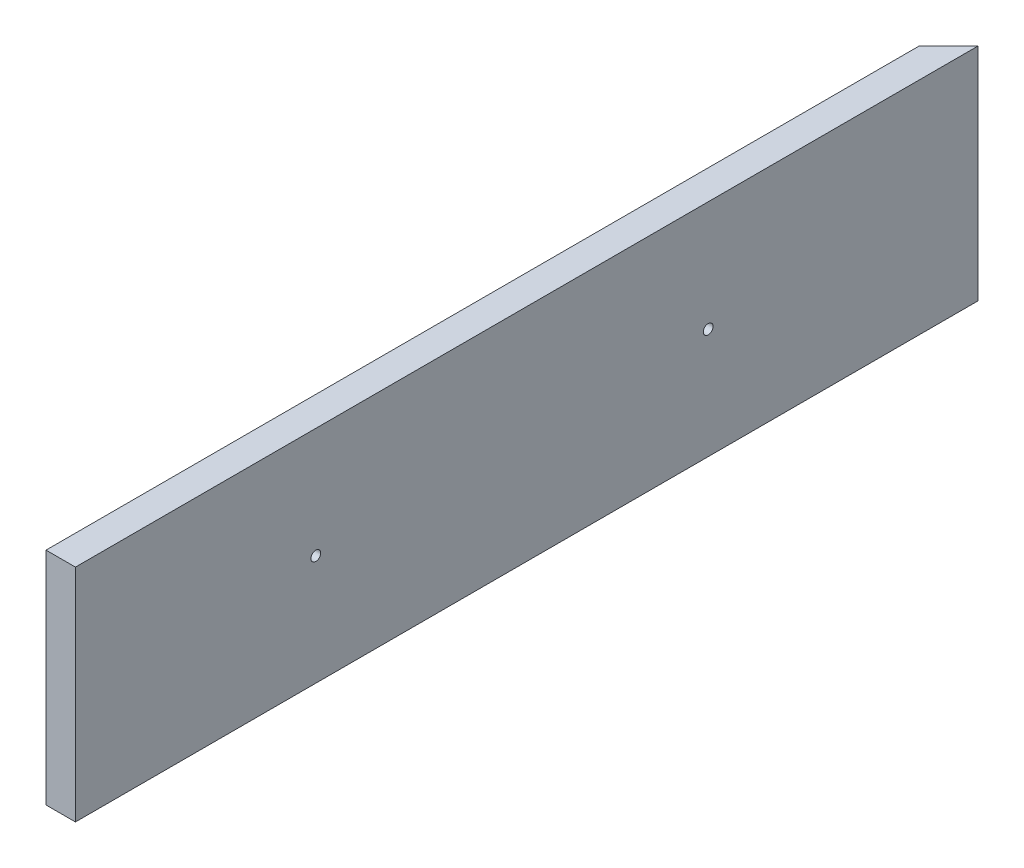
SolidWorks part; units mm, degrees
ref_plane "Front Plane" through (0, 0, 0) normal (0, 0, 1) x (1, 0, 0)
ref_plane "Top Plane" through (0, 0, 0) normal (0, 1, 0) x (1, 0, 0)
ref_plane "Right Plane" through (0, 0, 0) normal (1, 0, 0) x (0, 0, -1)
sketch "Sketch1" plane through (0, 0, 0) normal (0, 1, 0) x (1, 0, 0)
  line L0 (0, 1130.3) -> (38.1, 1168.4)
  line L1 (0, 0) -> (38.1, 0)
  line L2 (0, 0) -> (0, 1130.3)
  line L3 (0, 1130.3) -> (38.1, 1130.3) construction
  line L4 (38.1, 0) -> (38.1, 1130.3)
  line L5 (0, 0) -> (38.1, 1130.3) construction
  line L6 (0, 1130.3) -> (38.1, 0) construction
  line L7 (38.1, 1168.4) -> (38.1, 1130.3)
  point P4 (19.05, 565.15)
extrude "Boss-Extrude1" add sketch "Sketch1" along normal blind 285.75
sketch "Sketch2" plane through (0, 0, 0) normal (-1, 0, 0) x (0, 0, 1)
  line L0 (-1130.3, 142.875) -> (-819.15, 142.875) construction
  line L1 (-1130.3, 285.75) -> (-1130.3, 0) construction
  line L2 (0, 142.875) -> (-311.15, 142.875) construction
  line L3 (0, 285.75) -> (0, 0) construction
  circle A0 centre (-819.15, 142.875) radius 6.35
  circle A1 centre (-311.15, 142.875) radius 6.35
extrude "Cut-Extrude1" cut sketch "Sketch2" against normal through all
equation "\"system_width\"= 7ft + 10 "
equation "\"system_length\"= 95.5"
equation "\"module_board_length\"= 11.25in"
equation "\"module_board_width\"= 1.5in"
equation "\"module_width\"= (\"system_width\" -  2* \"module_trim_thickness\") / 2"
equation "\"module_length\"= (\"system_top_length\" - \"module_trim_thickness\")/ 2"
equation "\"module_board_long_depth\"= \"module_length\" - \"module_lip_width\""
equation "\"module_board_short_depth\"= \"module_width\" - ( 2 * \"module_board_width\" ) - \"module_lip_width\""
equation "\"module_board_hole\"= 0.5in"
equation "\"module_board_hole_position\"= ( ( \"module_width\" - \"module_board_hole_seperation\" ) / 2 ) + \"module_board_width\"/2"
equation "\"module_board_hole_seperation\"= 20in"
equation "\"module_top_length\"= \"module_length\" + \"module_lip_width\""
equation "\"module_top_width\"= \"module_width\" + \"module_lip_width\""
equation "\"module_top_thickness\"= 0.75in"
equation "\"module_lip_width\"= 1.5in"
equation "\"D1@Boss-Extrude1\"=\"module_board_length\""
equation "\"system_step_width\"= 3ft"
equation "\"system_top_length\"= \"system_length\" - \"system_step_length\""
equation "\"module_trim_thickness\"= 1in"
equation "\"module_trim_height\"= 14in"
equation "\"D1@Sketch1\"=\"module_width\" - \"module_lip_width\""
equation "\"D2@Sketch1\"=\"module_lip_width\""
equation "\"D1@Sketch2\"=\"module_board_hole_seperation\""
equation "\"D2@Sketch2\"=\"module_board_hole\""
equation "\"step_board_length\"= 5.5in"
equation "\"step_board_width\"= 1.5in"
equation "\"system_step_length\"= 2ft+11.5"
equation "\"module_top_overhang\"= 4.5in"
equation "\"module_trim_angle\"= 45deg"
equation "\"step_module_width\"= \"module_width\""
equation "\"step_module_length\"= \"system_step_length\" - \"module_trim_thickness\""
equation "\"step_board_short_depth\"= \"step_module_length\" - \"module_lip_width\""
equation "\"step_board_long_depth\"= \"step_module_width\" - (2 * \"module_board_width\") - \"module_lip_width\""
